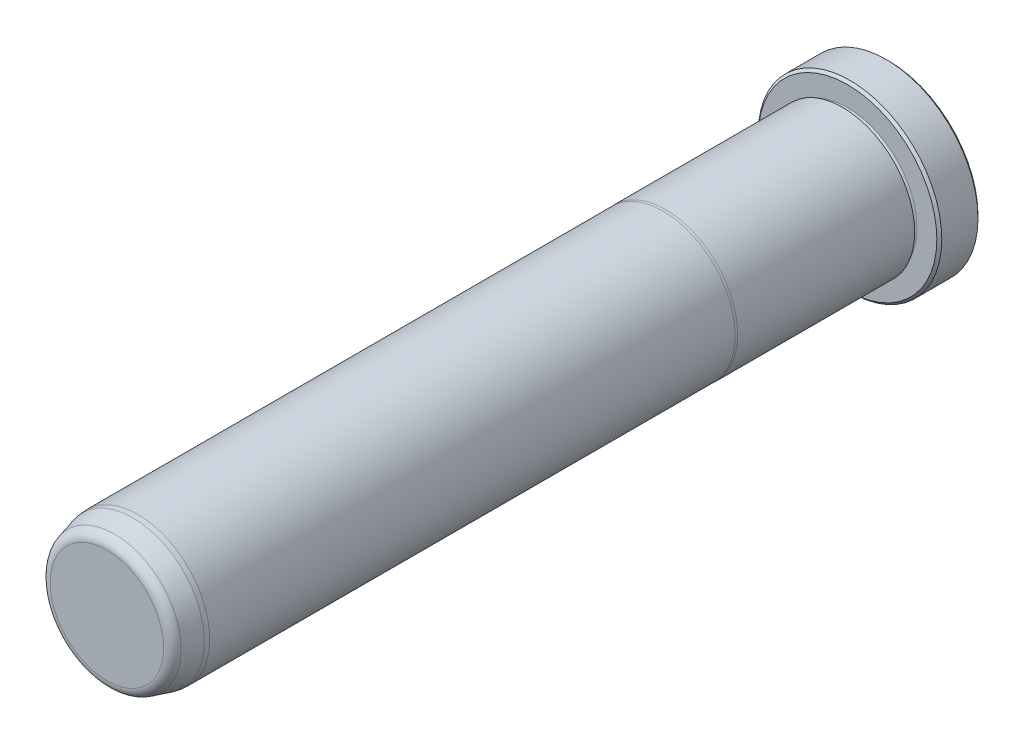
SolidWorks part; units mm, degrees
ref_plane "Front Plane" through (0, 0, 0) normal (0, 0, 1) x (1, 0, 0)
ref_plane "Top Plane" through (0, 0, 0) normal (0, 1, 0) x (1, 0, 0)
ref_plane "Right Plane" through (0, 0, 0) normal (1, 0, 0) x (0, 0, -1)
sketch "Sketch1" plane through (0, 0, 0) normal (1, 0, 0) x (0, 0, -1)
  line L0 (0, 0) -> (0, 14.1605)
  line L1 (0, 14.1605) -> (-6.35, 14.1605)
  line L2 (-6.35, 14.1605) -> (-6.35, 10.7188)
  line L3 (-6.35, 10.3378) -> (-7.112, 10.3378) construction
  line L4 (-7.112, 10.7188) -> (-7.112, 11.1252)
  line L5 (-7.112, 11.1252) -> (-34.4348, 11.1252)
  line L6 (-34.4348, 11.1252) -> (-34.798, 11.0998)
  line L7 (-34.798, 11.0998) -> (-115.8875, 11.0998)
  line L9 (-120.65, 9.9612) -> (-120.65, 0)
  line L10 (-120.65, 0) -> (0, 0)
  line L11 (0, 0) -> (13.6287, 0) construction
  line L12 (-115.8875, 11.0998) -> (-116.6495, 11.0331)
  line L13 (-116.6495, 11.0331) -> (-120.65, 9.9612)
  arc A0 (-7.112, 10.7188) -> (-6.35, 10.7188) centre (-6.731, 10.7188) ccw
  dimension "D14" = 0.762
  dimension "D1" = 6.35
  dimension "D2" = 0.762
  dimension "D3" = 28.321
  dimension "D4" = 22.2504
  dimension "D5" = 34.798
  dimension "D6" = 120.65
  dimension "D7" = 0.7874
  dimension "D8" = 4
  dimension "D9" = 22.1996
  dimension "D10" = 5
  dimension "D11" = 15
  dimension "D12" = 0.762
  dimension "D13" = 4.7625
revolve "Revolve1" add sketch "Sketch1" angle 360 about L11
fillet "Fillet6" radius 1.5875 1 edges at (9.9612, 0, 120.65)
chamfer "Chamfer1" distance 0.381 angle 45 2 edges at (14.1605, 0, 0) (14.1605, 0, 6.35)
